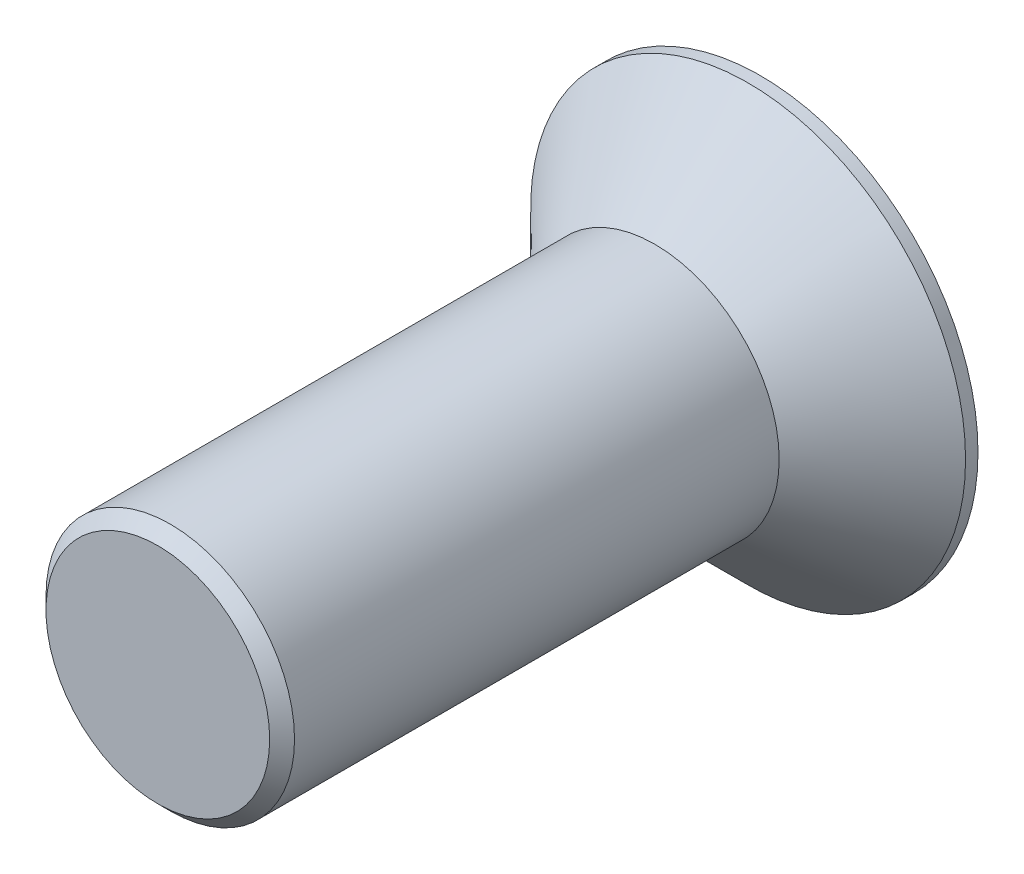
SolidWorks part; units mm, degrees
ref_plane "Front Plane" through (0, 0, 0) normal (0, 0, 1) x (1, 0, 0)
ref_plane "Top Plane" through (0, 0, 0) normal (0, 1, 0) x (1, 0, 0)
ref_plane "Right Plane" through (0, 0, 0) normal (1, 0, 0) x (0, 0, -1)
sketch "Sketch1" plane through (0, 0, 0) normal (0, 0, 1) x (1, 0, 0)
  circle A0 centre (0, 0) radius 2
  dimension "D1" = 4
extrude "Extrude1" add sketch "Sketch1" along normal blind 8
chamfer "Chamfer1" distance 0.2 angle 45 1 edges at (2, 0, 8)
sketch "Sketch3" plane through (0, 0, 0) normal (0, 1, 0) x (1, 0, 0)
  line L0 (-2, 0) -> (-3.5, 1.5)
  line L1 (-3.5, 1.5) -> (-3.5, 1.7)
  line L2 (-3.5, 1.7) -> (0, 1.7)
  line L3 (0, 1.7) -> (0, 0)
  line L4 (0, 0) -> (-2, 0)
  line L5 (0, 0) -> (0, 3.6806) construction
  dimension "D1" = 7
  dimension "D2" = 45
  dimension "D3" = 0.2
revolve "Revolve1" add sketch "Sketch3" angle 360 about L5
sketch "Sketch4" plane through (0, 0, -1.7) normal (0, 0, -1) x (-1, 0, 0)
  line L1 (-0.25, 3.1002) -> (0.25, 3.1002)
  line L2 (-0.25, 3.1002) -> (-0.25, -3.1002)
  line L3 (-0.25, -3.1002) -> (0.25, -3.1002)
  line L4 (0.25, 3.1002) -> (0.25, -3.1002)
  line L5 (-0.25, 3.1002) -> (0.25, -3.1002) construction
  line L6 (-0.25, -3.1002) -> (0.25, 3.1002) construction
  point P0 (0, 0)
  dimension "D1" = 0.5
extrude "Extrude2" cut sketch "Sketch4" against normal blind 0.5
